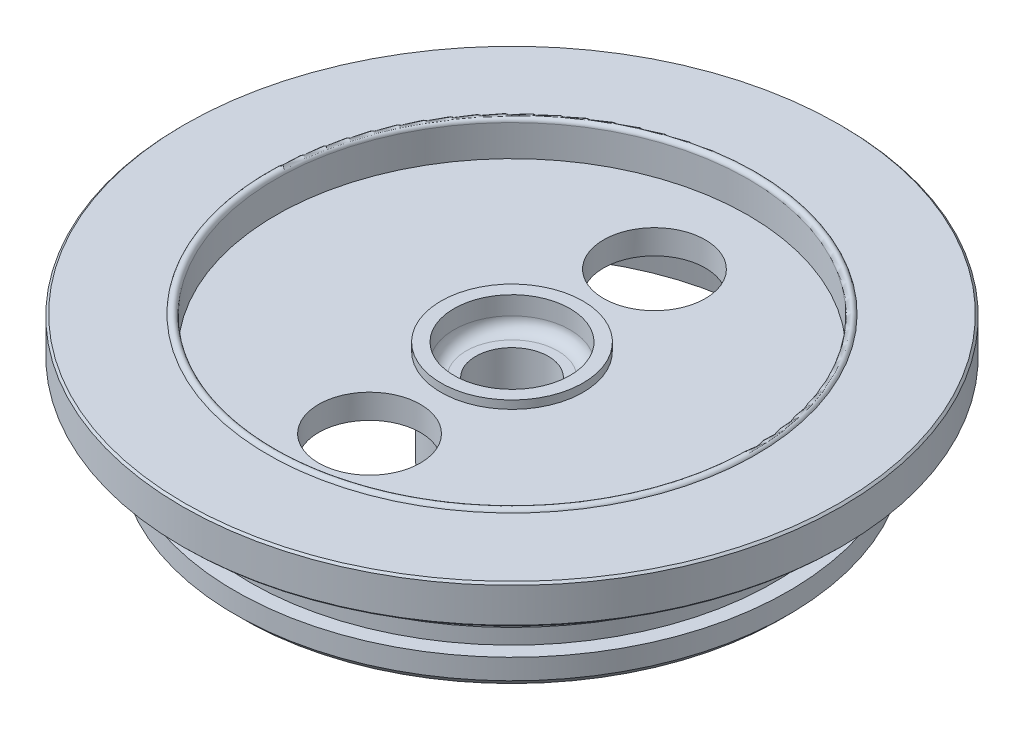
SolidWorks part; units mm, degrees
ref_plane "Plan de face" through (0, 0, 0) normal (0, 0, 1) x (1, 0, 0)
ref_plane "Plan de dessus" through (0, 0, 0) normal (0, 1, 0) x (1, 0, 0)
ref_plane "Plan de droite" through (0, 0, 0) normal (1, 0, 0) x (0, 0, -1)
sketch "Esquisse1" plane through (0, 0, 0) normal (0, 0, 1) x (1, 0, 0)
  line L0 (8.925, 5.361) -> (12.8, 5.361)
  line L1 (13.8, 6.361) -> (13.8, 34.4986)
  line L2 (13.8, 34.4986) -> (16.8, 34.4986)
  line L3 (16.8, 34.4986) -> (16.8, 51.361)
  line L4 (16.8, 51.361) -> (59.6491, 51.361)
  line L5 (59.6491, 51.361) -> (62.5, 33.361)
  line L6 (62.5, 33.361) -> (66, 33.361)
  line L7 (68, 35.361) -> (68, 40.361)
  line L8 (68, 55.861) -> (80.5, 55.861)
  line L9 (81, 56.361) -> (81, 64.861)
  line L10 (80.5, 65.361) -> (59.9509, 65.361)
  line L11 (68, 46.711) -> (64.35, 46.711)
  line L12 (64.35, 46.711) -> (64.35, 40.361)
  line L13 (0, 0) -> (0, 70.224) construction
  line L14 (58.0037, 65.0404) -> (58.0037, 57.361)
  line L15 (17.45, 59.361) -> (14.25, 59.361)
  line L16 (12.8, 5.361) -> (13.8, 6.361)
  line L17 (58.0037, 57.361) -> (17.45, 57.361)
  line L18 (17.45, 57.361) -> (17.45, 59.361)
  line L19 (8.925, 51.861) -> (8.925, 5.361)
  line L20 (64.35, 40.361) -> (68, 40.361)
  line L21 (68, 46.711) -> (68, 55.861)
  line L22 (66, 33.361) -> (68, 35.361)
  line L23 (80.5, 55.861) -> (81, 56.361)
  line L24 (81, 64.861) -> (80.5, 65.361)
  line L25 (8.925, 51.861) -> (11.25, 51.861)
  line L26 (14.25, 54.861) -> (14.25, 59.361)
  arc A0 (59.9509, 65.361) -> (58.0037, 65.0404) centre (59.0037, 65.0404) ccw
  arc A1 (11.25, 51.861) -> (14.25, 54.861) centre (11.25, 54.861) ccw
  point P1 (13.8, 5.361)
  point P8 (68, 33.361)
  point P9 (81, 65.361)
  point P11 (81, 55.861)
  dimension "D3" = 1
  dimension "D4" = 13.5
  dimension "D19" = 3
  dimension "D5" = 25
  dimension "D6" = 3
  dimension "D7" = 81
  dimension "D8" = 68
  dimension "D9" = 62.5
  dimension "D10" = 6.35
  dimension "D11" = 9.5
  dimension "D12" = 32
  dimension "D13" = 64.35
  dimension "D14" = 81
  dimension "D15" = 14.25
  dimension "D16" = 6
  dimension "D17" = 8
  dimension "D18" = 8.925
  dimension "D20" = 13.8
  dimension "D21" = 60
  dimension "D25" = 6
revolve "Révolution1" add sketch "Esquisse1" angle 360 about L13
sketch "Esquisse2" plane through (0, 57.361, 0) normal (0, 1, 0) x (1, 0, 0)
  circle A0 centre (0, 35) radius 12.5
  circle A1 centre (0, -35) radius 12.5
  dimension "D1" = 25
  dimension "D2" = 35
  dimension "D4" = 25
  dimension "D3" = 35
extrude "Enlèv. mat.-Extru.1" cut sketch "Esquisse2" against normal blind 10
